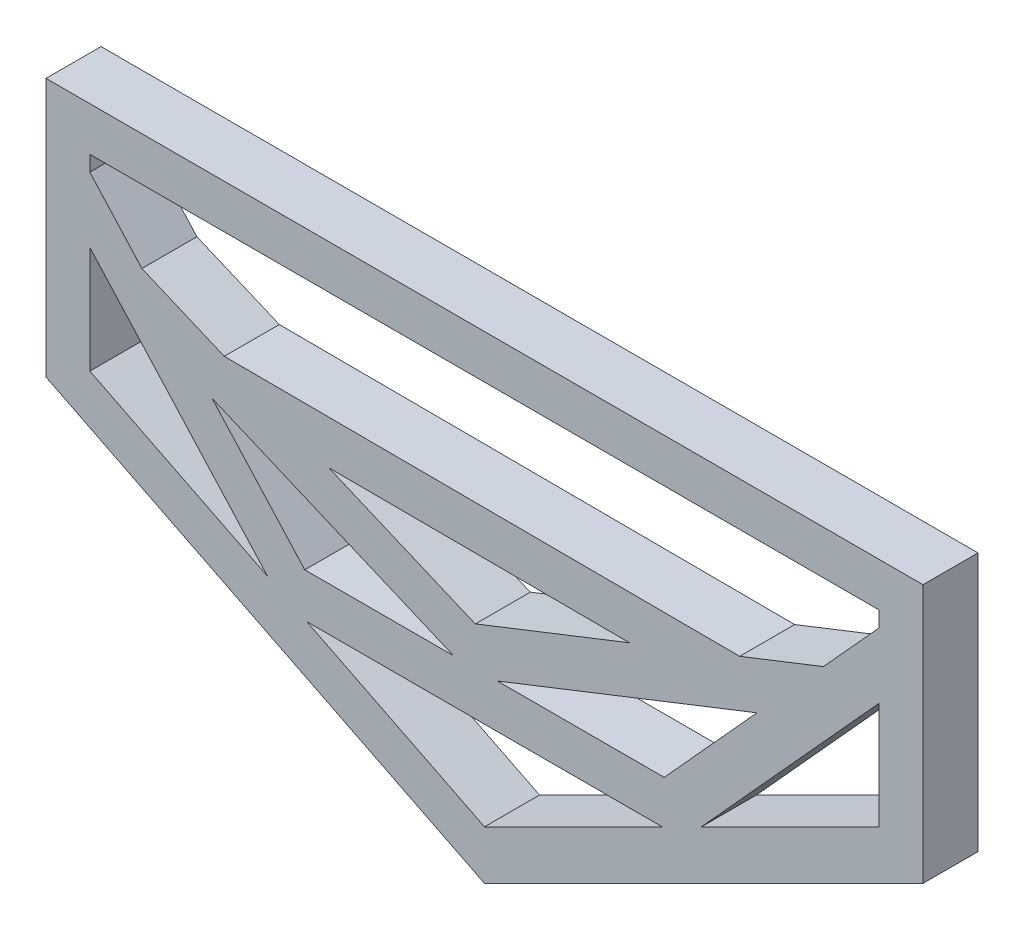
SolidWorks part; units mm, degrees
ref_plane "Front Plane" through (0, 0, 0) normal (0, 0, 1) x (1, 0, 0)
ref_plane "Top Plane" through (0, 0, 0) normal (0, 1, 0) x (1, 0, 0)
ref_plane "Right Plane" through (0, 0, 0) normal (1, 0, 0) x (0, 0, -1)
sketch "Sketch1" plane through (0, 0, 0) normal (0, 0, 1) x (1, 0, 0)
  line L0 (-115, 120.1429) -> (-115, 30.8)
  line L3 (172.7143, 105) -> (172.7143, 99.6595)
  line L4 (187.8571, 120.1429) -> (187.8571, 30.8)
  line L5 (36.4286, -27.9841) -> (97.7993, 2.7013)
  line L6 (-99.8571, 40.1588) -> (-38.4864, 9.4734)
  line L7 (-99.8571, 105) -> (-99.8571, 99.6595)
  line L8 (-115, 120.1429) -> (187.8571, 120.1429)
  line L9 (-115, 30.8) -> (36.4286, -44.9143)
  line L10 (36.4286, -44.9143) -> (187.8571, 30.8)
  line L11 (-99.8571, 105) -> (172.7143, 105)
  line L18 (-17.3197, 52.5105) -> (86.4908, 52.0836)
  line L19 (-53.4396, 67.802) -> (124.5514, 67.0701)
  line L21 (-99.8571, 77.1223) -> (-38.4864, 9.4734)
  line L22 (-24.9422, 2.7013) -> (97.7993, 2.7013)
  line L23 (111.3435, 9.4734) -> (172.7143, 77.1223)
  line L25 (-99.8571, 99.6595) -> (-81.8786, 79.8417)
  line L26 (-25.6346, 17.8442) -> (25.723, 17.8442)
  line L27 (98.4918, 17.8442) -> (130.5157, 53.1441)
  line L28 (-57.6586, 53.1441) -> (25.723, 17.8442)
  line L29 (40.8659, 17.8442) -> (130.5157, 53.1441)
  line L30 (33.2944, 31.1374) -> (33.2944, 31.0828)
  line L31 (-24.9422, 2.7013) -> (36.4286, -27.9841)
  line L33 (-81.8786, 79.8417) -> (-53.4396, 67.802)
  line L34 (33.2944, 31.1374) -> (86.4908, 52.0836)
  line L37 (111.3435, 9.4734) -> (172.7143, 40.1588)
  line L39 (40.8659, 17.8442) -> (98.4918, 17.8442)
  line L43 (-17.3197, 52.5105) -> (33.2944, 31.0828)
  line L44 (172.7143, 77.1223) -> (172.7143, 40.1588)
  line L46 (-99.8571, 77.1223) -> (-99.8571, 40.1588)
  line L52 (-57.6586, 53.1441) -> (-25.6346, 17.8442)
  line L54 (153.4846, 78.4627) -> (172.7143, 99.6595)
  line L57 (124.5514, 67.0701) -> (153.4846, 78.4627)
  dimension "D1" = 126.87
extrude "Boss-Extrude1" add sketch "Sketch1" along normal blind 19
